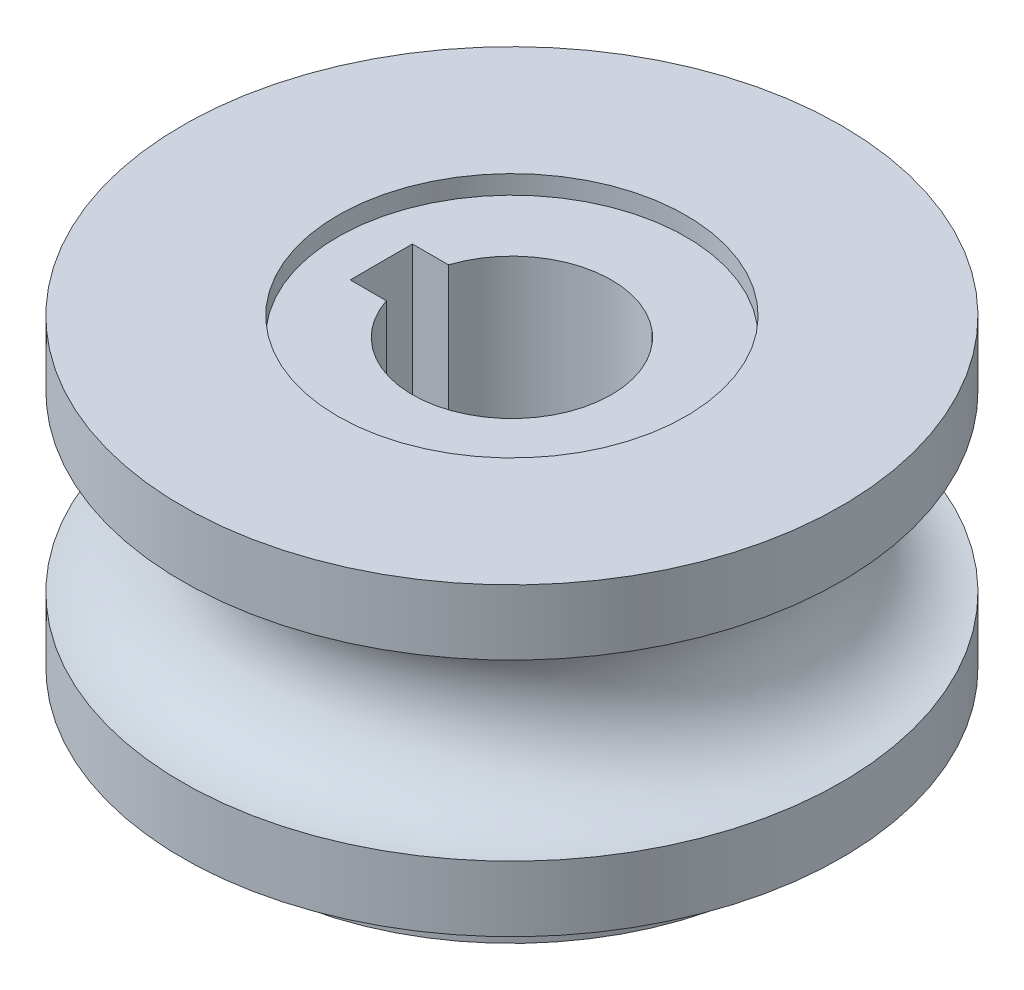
SolidWorks part; units mm, degrees
ref_plane "Plan1" through (0, 0, 0) normal (0, 0, 1) x (1, 0, 0)
ref_plane "Plan2" through (0, 0, 0) normal (0, 1, 0) x (1, 0, 0)
ref_plane "Plan3" through (0, 0, 0) normal (1, 0, 0) x (0, 0, -1)
sketch "Esquisse1" plane through (0, 0, 0) normal (0, 0, 1) x (1, 0, 0)
  line L0 (0, 0) -> (0, 30) construction
  line L1 (0, 0) -> (6.5, 0)
  line L2 (6.5, 0) -> (6.5, 0.5)
  line L3 (6.5, 0.5) -> (10.75, 0.5)
  line L4 (10.75, 0.5) -> (10.75, 2.5)
  line L5 (10.75, 2.5) -> (13.25, 2.5)
  line L6 (13.25, 2.5) -> (13.25, 5.13)
  line L7 (13.25, 12.13) -> (13.25, 14.75)
  line L8 (13.25, 14.75) -> (0, 14.75)
  line L9 (0, 14.75) -> (0, 0)
  arc A0 (13.25, 12.13) -> (13.25, 5.13) centre (13.25, 8.63) ccw
  dimension "D4" = 7
  dimension "D1" = 6.5
  dimension "D2" = 10.75
  dimension "D3" = 13.25
  dimension "D5" = 8.63
  dimension "D6" = 0.5
  dimension "D7" = 2.5
  dimension "D8" = 14.75
revolve "Base-Révolution" add sketch "Esquisse1" angle 360 about L0
sketch "Esquisse2" plane through (0, 0, 0) normal (0, -1, 0) x (1, 0, 0)
  circle A0 centre (0, 0) radius 4.75
  circle A1 centre (0, 0) radius 6.5 construction
  dimension "D1" = 9.5
extrude "Enlèv. mat.-Extru.1" cut sketch "Esquisse2" against normal blind 0.75
sketch "Esquisse3" plane through (0, 14.75, 0) normal (0, 1, 0) x (-1, 0, 0)
  circle A0 centre (0, 0) radius 7
  dimension "D1" = 14
extrude "Enlèv. mat.-Extru.2" cut sketch "Esquisse3" against normal blind 0.75
sketch "Esquisse4" plane through (0, 14, 0) normal (0, 1, 0) x (-1, 0, 0)
  circle A0 centre (0, 0) radius 4
  dimension "D1" = 8
extrude "Enlèv. mat.-Extru.3" cut sketch "Esquisse4" against normal through all
sketch "Esquisse5" plane through (0, 14, 0) normal (0, 1, 0) x (-1, 0, 0)
  line L1 (5.25, -1.25) -> (3.7997, -1.25)
  line L2 (5.25, -1.25) -> (5.25, 1.25)
  line L3 (5.25, 1.25) -> (3.7997, 1.25)
  circle A0 centre (0, 0) radius 4 construction
  arc A1 (3.7997, -1.25) -> (3.7997, 1.25) centre (0, 0) ccw
  dimension "D1" = 1.25
  dimension "D2" = 2.5
  dimension "D3" = 5.25
extrude "Enlèv. mat.-Extru.4" cut sketch "Esquisse5" against normal through all
